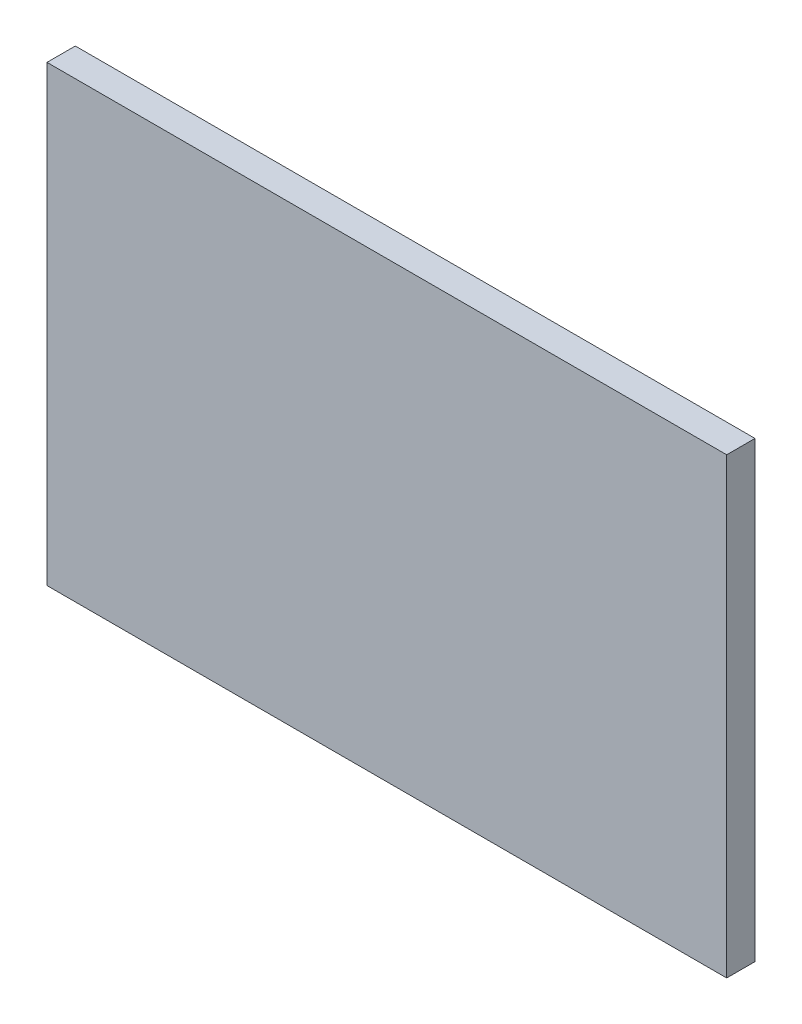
SolidWorks part; units mm, degrees
ref_plane "Front Plane" through (0, 0, 0) normal (0, 0, 1) x (1, 0, 0)
ref_plane "Top Plane" through (0, 0, 0) normal (0, 1, 0) x (1, 0, 0)
ref_plane "Right Plane" through (0, 0, 0) normal (1, 0, 0) x (0, 0, -1)
sketch "Sketch1" plane through (0, 0, 0) normal (0, 0, 1) x (1, 0, 0)
  line L1 (0, 0) -> (-76.2, 0)
  line L2 (0, 0) -> (0, -50.8)
  line L3 (0, -50.8) -> (-76.2, -50.8)
  line L4 (-76.2, 0) -> (-76.2, -50.8)
  dimension "D1" = 76.2
  dimension "D2" = 50.8
extrude "Extrude1" add sketch "Sketch1" along normal blind 3.175
